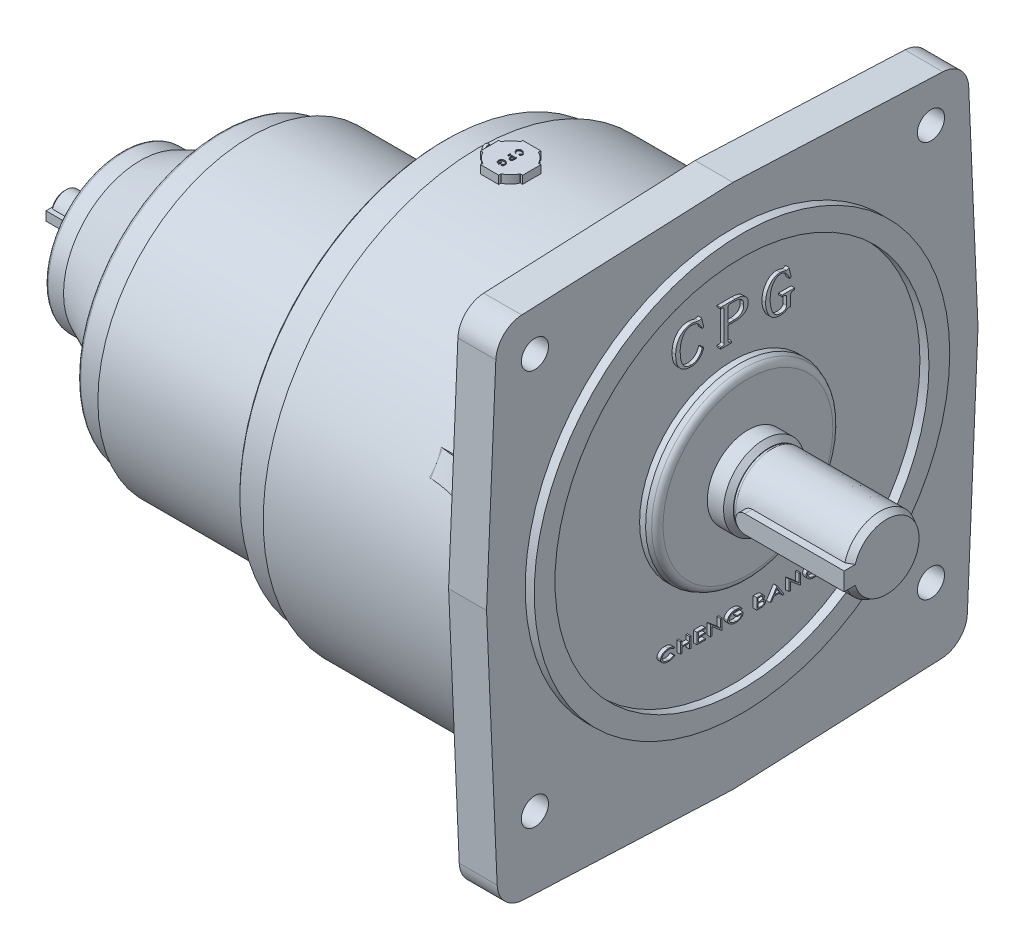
SolidWorks part; units mm, degrees
ref_plane "前基準面" through (0, 0, 0) normal (0, 0, 1) x (1, 0, 0)
ref_plane "上基準面" through (0, 0, 0) normal (0, 1, 0) x (1, 0, 0)
ref_plane "右基準面" through (0, 0, 0) normal (1, 0, 0) x (0, 0, -1)
sketch "草圖1" plane through (0, 0, 0) normal (0, 0, 1) x (1, 0, 0)
  line L0 (-0.0005, 119) -> (-0.0005, 0)
  line L1 (-120, 119) -> (-120, 113)
  line L2 (-120, 119) -> (-0.0005, 119)
  line L3 (-120, 113) -> (-121, 114)
  line L4 (-120, 113) -> (-121, 114)
  line L5 (-120, 119) -> (-120, 113)
  line L6 (-120, 113) -> (-121, 114)
  line L7 (-120, 113) -> (-121, 114)
  line L9 (-138.9, 113) -> (-138.9, 94.5)
  line L11 (-137.9, 114) -> (-121, 114)
  line L12 (-137.9, 114) -> (-138.9, 113)
  line L15 (-138.9, 94.5) -> (-138.9, 0)
  line L18 (-138.9, 0) -> (-0.0005, 0)
  line L28 (-518.6245, 0) -> (42.0523, 0) construction
revolve "旋轉1" add sketch "草圖1" angle 360 about L28
sketch "草圖6" plane through (0, 0, 0) normal (0, 0, 1) x (1, 0, 0)
  line L0 (-0.0005, 36) -> (143.3121, 36) construction
  line L1 (149.6, 0) -> (-149.6, 0) construction
  line L2 (106.0003, 36) -> (21.0003, 36)
  line L3 (42.5003, 56) -> (102.3093, 56)
  line L4 (41.0003, 55.809) -> (41.0003, 55.5)
  line L5 (42.5003, 56) -> (42.5003, 55.5)
  line L6 (-0.0005, 119) -> (-0.0005, 0) construction
  line L7 (24.3093, 87.6674) -> (21.0003, 87.6674)
  line L8 (106.0003, 54) -> (106.0003, 36)
  line L9 (29.3093, 83.006) -> (29.3093, 58.5)
  line L10 (38.3093, 58.5) -> (29.3093, 58.5)
  line L11 (102.3093, 56) -> (106.0003, 54)
  line L12 (41.0003, 55.809) -> (38.3093, 58.5)
  line L13 (42.5003, 55.5) -> (41.0003, 55.5)
  line L14 (26.7333, 86.7439) -> (24.3093, 87.6674)
  line L16 (21.0003, 87.6674) -> (21.0003, 36)
  arc A5 (29.3093, 83.006) -> (26.7333, 86.7439) centre (25.3093, 83.006) ccw
  point P5 (106.0003, 56)
  dimension "D1" = 36
  dimension "D2" = 65
  dimension "D3" = 40.0001
  dimension "D4" = 85
  dimension "D5" = 45.0001
revolve "旋轉3" add sketch "草圖6" angle 360 about L2
sketch "草圖8" plane through (-0.0005, 0, 0) normal (1, 0, 0) x (0, 0, -1)
  line L1 (0, 173) -> (-116.9067, 167.8957)
  line L2 (-131.2381, 153.5643) -> (-136.3711, 36)
  line L3 (-116.1631, -112.9282) -> (0, -118)
  line L4 (0, -118) -> (115.4194, -112.9607)
  line L5 (-136.3711, 36) -> (-130.4945, -98.5968)
  line L6 (116.1631, 167.9282) -> (0, 173)
  line L7 (130.4945, 153.5968) -> (135.6289, 36)
  line L8 (135.6289, 36) -> (129.7508, -98.6292)
  line L9 (0, 201.9695) -> (0, -167.8269) construction
  line L10 (164.2845, 36) -> (-222.6619, 36) construction
  arc A0 (-116.9067, 167.8957) -> (-131.2381, 153.5643) centre (-116.2524, 152.91) ccw
  arc A1 (130.4945, 153.5968) -> (116.1631, 167.9282) centre (115.5088, 152.9425) ccw
  arc A2 (115.4194, -112.9607) -> (129.7508, -98.6292) centre (114.7651, -97.975) ccw
  arc A3 (-130.4945, -98.5968) -> (-116.1631, -112.9282) centre (-115.5088, -97.9425) ccw
  circle A4 centre (0, 36) radius 155 construction
  circle A5 centre (109.6016, 145.6016) radius 7.5
  circle A6 centre (-109.6, 145.6031) radius 7.5
  circle A7 centre (-109.6016, -73.6016) radius 7.5
  circle A8 centre (109.6016, -73.6016) radius 7.5
  circle A9 centre (0, 36) radius 115 construction
  dimension "D3" = 15
  dimension "D14" = 310
  dimension "D16" = 15
  dimension "D5" = 15
  dimension "D6" = 15
  dimension "D11" = 15
  dimension "D9" = 230
  dimension "D2" = 291
  dimension "D4" = 175
  dimension "D7" = 109.6
  dimension "D13" = 272
ref_plane "平面1" through (0, 36, 0) normal (0, 1, 0) x (-1, 0, 0)
extrude "伸長9" add sketch "草圖8" along normal blind 21
sketch "草圖24"
extrude "伸長12" add sketch "草圖24" along normal blind 2
sketch "草圖25" plane through (0, 0, 0) normal (0, 0, 1) x (1, 0, 0)
  line L1 (-0.0005, 119) -> (-120, 119) construction
  arc A0 (0, 148.7687) -> (-39.9649, 119) centre (-51.9373, 176.7842) cw
rib "肋材4" sketch "草圖25" sketch "草圖25" thickness 13 parameters "D1"=13
pattern_circular "環狀複製排列10" count 6 over 360 about axis through (0, 0, 0) along (1, 0, 0) of "肋材4"
sketch "草圖28" plane through (0, 0, 0) normal (0, 0, 1) x (1, 0, 0)
  line L2 (-138.9, 67.2576) -> (-138.9, -23)
  line L3 (-143.9, 61.5) -> (-246, 61.5)
  line L9 (-143.9, 67.2576) -> (-143.9, 61.5)
  line L11 (-138.9, 67.2576) -> (-143.9, 67.2576)
  line L15 (-246, 61.5) -> (-246, -23)
  line L22 (-246, -23) -> (-138.9, -23)
  line L27 (-472.8434, -23) -> (-71.0676, -23) construction
  line L28 (-0.0005, 36) -> (143.3121, 36) construction
  dimension "D1" = 59
  dimension "D2" = 102.1
revolve "旋轉4" add sketch "草圖28" angle 360 about L27
sketch "草圖29" plane through (20.9995, 0, 0) normal (1, 0, 0) x (0, 0, -1)
  line L0 (0, 0) -> (0, 99.0555) construction
  circle A0 centre (0, 36) radius 115
  circle A1 centre (0, 36) radius 103.5
  dimension "D1" = 207
  dimension "D2" = 230
extrude "伸長14" add sketch "草圖29" along normal blind 5
sketch "草圖30" plane through (0, 0, 0) normal (0, 0, 1) x (1, 0, 0)
  line L0 (-386.0837, -23) -> (-228.3024, -23) construction
  line L1 (-246, -23) -> (-349, -23)
  line L2 (-246, 56) -> (-261, 56)
  line L5 (-262.5, 40) -> (-307, 19.5)
  line L6 (-320.5, -15) -> (-320.5, -15.05)
  line L7 (-246, 61.5) -> (-246, -23) construction
  line L8 (-246, 61.5) -> (-246, -23)
  line L9 (-315.5, 19.5) -> (-307, 19.5)
  line L10 (-262.5, 54.5) -> (-262.5, 40)
  line L11 (-320.5, -15) -> (-348, -15)
  line L12 (-319, -15.05) -> (-320.5, -15.05)
  line L13 (-318.5, -13.25) -> (-319, -13.55)
  line L14 (-349, -23) -> (-349, -16)
  line L15 (-349, -16) -> (-348, -15)
  line L16 (-317, -13.25) -> (-318.5, -13.25)
  line L18 (-246, 56) -> (-246, -23)
  line L19 (-319, -13.55) -> (-319, -15.05)
  line L20 (-317, -13.25) -> (-317, 18)
  arc A2 (-315.5, 19.5) -> (-317, 18) centre (-315.5, 18) ccw
  arc A3 (-261, 56) -> (-262.5, 54.5) centre (-261, 54.5) ccw
  dimension "D1" = 59
  dimension "D2" = 16
  dimension "D3" = 30
  dimension "D4" = 455.0003
  dimension "D5" = 158
  dimension "D6" = 103
  dimension "D7" = 30
revolve "旋轉5" add sketch "草圖30" angle 360 about L0
ref_plane "平面2" through (0, -23, 0) normal (0, 1, 0) x (-1, 0, 0)
sketch "草圖31" plane through (0, 0, 0) normal (0, 0, 1) x (1, 0, 0)
  line L0 (197.6396, 36) -> (12.206, 36) construction
  line L1 (20.9995, 36) -> (-0.0005, 36) construction
  line L2 (106.0003, 41) -> (51.0003, 41)
  line L4 (106.0003, 18) -> (106.0003, 54) construction
  line L5 (51.0003, 31) -> (106.0003, 31)
  line L6 (106.0003, 31) -> (106.0003, 41)
  line L7 (46.0003, 36) -> (46.0003, 81.9414) construction
  line L8 (149.5003, 36) -> (149.5003, 72.0251) construction
  arc A0 (51.0003, 41) -> (51.0003, 31) centre (51.0003, 36) ccw
  dimension "D1" = 10
  dimension "D2" = 5
  dimension "D3" = 60
  dimension "D4" = 20
  dimension "D5" = 43.5
extrude "伸長15" add sketch "草圖31" along normal blind 23.5
sketch "草圖32" plane through (0, 0, 0) normal (0, 0, 1) x (1, 0, 0)
  line L0 (-371.5448, -23) -> (-310.3635, -23) construction
  line L1 (-349, -20.5) -> (-324.5, -20.5)
  line L3 (-349, -16) -> (-349, -30) construction
  line L4 (-324.5, -25.5) -> (-349, -25.5)
  line L5 (-349, -25.5) -> (-349, -20.5)
  line L6 (-322, -23) -> (-322, -9.0913) construction
  line L7 (-367.2, -23) -> (-367.2, -8.3458) construction
  arc A0 (-324.5, -20.5) -> (-324.5, -25.5) centre (-324.5, -23) cw
  dimension "D1" = 5
  dimension "D2" = 2.5
  dimension "D3" = 8
  dimension "D4" = 27
  dimension "D5" = 18.2
extrude "伸長16" add sketch "草圖32" along normal blind 10.2
ref_plane "平面3" through (0, 123.3, 0) normal (0, 1, 0) x (-1, 0, 0)
sketch "草圖33" plane through (0, 123.3, 0) normal (0, 1, 0) x (-1, 0, 0)
  line L0 (97, 11.65) -> (107, 11.65)
  line L1 (97, 11.65) -> (97, 10.5119)
  line L2 (107, 11.65) -> (107, 10.5119)
  line L3 (97, -10.5119) -> (97, -11.65)
  line L4 (107, -10.5119) -> (107, -11.65)
  line L5 (90.35, 5) -> (91.4881, 5)
  line L6 (90.35, -5) -> (91.4881, -5)
  line L7 (90.35, -5) -> (90.35, 5)
  line L8 (97, -11.65) -> (97, -10.5119)
  line L9 (107, -11.65) -> (107, -10.5119)
  line L10 (107, -11.65) -> (97, -11.65)
  line L11 (113.65, -5) -> (112.5119, -5)
  line L12 (113.65, 5) -> (112.5119, 5)
  line L13 (113.65, 5) -> (113.65, -5)
  arc A0 (96.8617, 10.2882) -> (91.7118, 5.1383) centre (102, 0) ccw
  arc A1 (96.8617, 10.2882) -> (97, 10.5119) centre (96.75, 10.5119) ccw
  arc A2 (107, 10.5119) -> (107.1383, 10.2882) centre (107.25, 10.5119) ccw
  arc A3 (91.4881, 5) -> (91.7118, 5.1383) centre (91.4881, 5.25) ccw
  arc A4 (91.7118, -5.1383) -> (91.4881, -5) centre (91.4881, -5.25) ccw
  arc A5 (97, -10.5119) -> (96.8617, -10.2882) centre (96.75, -10.5119) ccw
  arc A6 (107.1383, -10.2882) -> (107, -10.5119) centre (107.25, -10.5119) ccw
  arc A7 (112.5119, -5) -> (112.2882, -5.1383) centre (112.5119, -5.25) ccw
  arc A8 (112.2882, 5.1383) -> (112.5119, 5) centre (112.5119, 5.25) ccw
  arc A9 (112.2882, 5.1383) -> (107.1383, 10.2882) centre (102, 0) ccw
  arc A10 (91.7118, -5.1383) -> (96.8617, -10.2882) centre (102, 0) ccw
  arc A11 (107.1383, -10.2882) -> (112.2882, -5.1383) centre (102, 0) ccw
extrude "伸長17" add sketch "草圖33" against normal blind 4.5 separate body contours A6 A11 A7 L11 L13 L12 A8 A9 A2 L2 L0 L1 A1 A0 A3 L5 L7 L6 A4 A10 A5 L3 L10 L4
sketch "草圖35"
extrude "伸長18" add sketch "草圖35" along normal blind 0.5
sketch "草圖36" plane through (0, 0, 0) normal (0, 0, 1) x (1, 0, 0)
  line L0 (-116.0418, 121.05) -> (-108.0418, 121.05)
  line L1 (-116.0418, 121.05) -> (-116.0418, 123.05)
  line L2 (-114.5418, 122.3) -> (-114.5418, 123.05)
  line L3 (149.6, 123.3) -> (-149.6, 123.3) construction
  line L13 (-112.5418, 122.3) -> (-108.0418, 122.05)
  line L15 (-114.5418, 122.3) -> (-112.5418, 122.3)
  line L23 (-116.0418, 123.05) -> (-114.5418, 123.05)
  line L24 (-112.5418, 121.05) -> (-112.5418, 122.3)
  line L25 (-108.0418, 121.05) -> (-108.0418, 122.05)
  dimension "D1" = 2.25
revolve "旋轉6" add sketch "草圖36" angle 360 about L0
equation "\"D5@草圖6\" = \"D3@草圖6\"+5"
equation "\"D2@草圖29\" = \"D1@草圖29\"+23"
equation "\"D1@伸長15\" = \"D5@草圖31\"-\"D3@草圖6\"/2"
equation "\"D1@伸長16\" = \"D5@草圖32\"-\"D2@草圖30\"/2"
